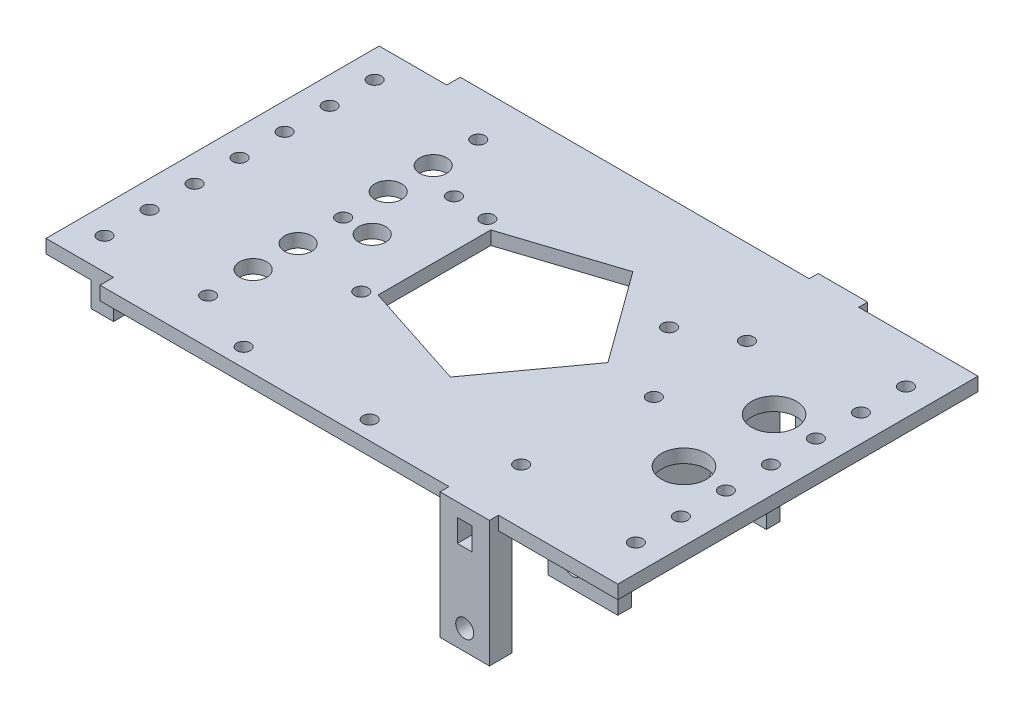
SolidWorks part; units mm, degrees
ref_plane "Plano frontal" through (0, 0, 0) normal (0, 0, 1) x (1, 0, 0)
ref_plane "Plano superior" through (0, 0, 0) normal (0, 1, 0) x (1, 0, 0)
ref_plane "Plano direito" through (0, 0, 0) normal (1, 0, 0) x (0, 0, -1)
sketch "Esboço1" plane through (0, 0, 0) normal (0, 1, 0) x (1, 0, 0)
  line L1 (-67.8295, 32.219) -> (62.1705, 32.219)
  line L2 (-67.8295, 32.219) -> (-67.8295, -47.781)
  line L3 (-67.8295, -47.781) -> (62.1705, -47.781)
  line L4 (62.1705, 32.219) -> (62.1705, -47.781)
  line L5 (-30.6295, -43.6864) -> (-30.6185, -43.6864)
  line L10 (-30.6295, -43.6864) -> (-30.6185, -43.6988)
  line L12 (-30.6185, -43.6864) -> (-30.6185, -43.6988) construction
  line L31 (35.6705, 32.219) -> (24.6705, 32.219)
  line L46 (18.4705, -6.281) -> (3.7526, 13.9765)
  line L47 (3.7526, 13.9765) -> (-20.0615, 6.2388)
  line L48 (-20.0615, 6.2388) -> (-20.0615, -18.8008)
  line L49 (-20.0615, -18.8008) -> (3.7526, -26.5385)
  line L50 (3.7526, -26.5385) -> (18.4705, -6.281)
  circle A0 centre (-25.0295, -43.6864) radius 1.5
  circle A1 centre (2.9705, -43.6864) radius 1.5
  circle A2 centre (-30.6185, 8.6141) radius 1.5
  circle A3 centre (18.4705, 7.3136) radius 1.5
  circle A4 centre (30.1705, -7.781) radius 1.5
  circle A5 centre (-61.8295, 22.219) radius 1.5
  circle A6 centre (-61.8295, 12.219) radius 1.5
  circle A7 centre (-61.8295, 2.219) radius 1.5
  circle A8 centre (-61.8295, -7.781) radius 1.5
  circle A9 centre (-61.8295, -17.781) radius 1.5
  circle A10 centre (-61.8295, -27.781) radius 1.5
  circle A11 centre (-61.8295, -37.781) radius 1.5
  circle A12 centre (56.1705, 22.219) radius 1.5
  circle A13 centre (56.1705, 12.219) radius 1.5
  circle A14 centre (56.1705, 2.219) radius 1.5
  circle A15 centre (56.1705, -7.781) radius 1.5
  circle A16 centre (56.1705, -17.781) radius 1.5
  circle A17 centre (56.1705, -27.781) radius 1.5
  circle A18 centre (56.1705, -37.781) radius 1.5
  circle A19 centre (46.8719, 2.219) radius 5
  circle A20 centre (46.8719, -17.781) radius 5
  circle A21 centre (-38.8295, 22.219) radius 1.5
  circle A22 centre (-38.8295, 12.219) radius 1.5
  circle A23 centre (-38.8295, 2.219) radius 1.5
  circle A24 centre (-38.8295, -7.781) radius 1.5
  circle A25 centre (-38.8295, -17.781) radius 1.5
  circle A26 centre (-38.8295, -27.781) radius 1.5
  circle A27 centre (-38.8295, -37.781) radius 1.5
  point P4 (-32.8295, 32.219)
  point P10 (-32.8295, -43.6864)
  point P13 (-30.6295, -43.6864)
  point P14 (-28.4295, -43.6864)
  point P15 (7.4705, -43.6864)
  point P16 (5.2705, -43.6864)
  point P21 (2.9705, -43.6864)
  point P22 (-25.0295, -43.6864)
  point P27 (18.4705, 22.3142)
  point P28 (-30.6185, 22.3142)
  point P29 (-30.6185, 8.6141)
  point P30 (18.4705, 7.3136)
  point P36 (30.1705, 32.219)
  point P39 (35.6705, 32.219)
  point P40 (24.6705, 32.219)
  point P45 (35.6705, 29.219)
  point P46 (35.6705, -44.781)
  point P51 (35.6705, 10.219)
  point P52 (35.6705, -25.781)
  point P53 (35.6705, 7.219)
  point P54 (35.6705, -22.781)
  point P61 (40.1705, 32.219)
  point P67 (30.1705, -7.781)
  point P74 (-52.8295, 32.219)
  point P75 (-47.8295, 32.219)
  point P80 (-61.8295, 32.219)
  point P81 (56.1705, 32.219)
  point P86 (-61.8295, 22.219)
  point P87 (-61.8295, 17.219)
  point P90 (56.1705, 22.219)
  point P105 (46.8719, 2.219)
  point P106 (46.8719, -17.781)
  point P123 (-2.8295, -6.281)
  point P124 (-38.8295, 32.219)
  point P132 (-38.8295, 22.219)
  dimension "D8" = 18.4705
  dimension "D16" = 62.1705
  dimension "D19" = 2.219
  dimension "D21" = 25.0295
  dimension "D22" = 28.4295
  dimension "D26" = 30.6295
  dimension "D3" = 3
  dimension "D4" = 2.9705
  dimension "D5" = 3.7526
  dimension "D6" = 5.2705
  dimension "D7" = 7.4705
  dimension "D9" = 24.6705
  dimension "D10" = 30.1705
  dimension "D11" = 30.6185
  dimension "D12" = 40.1705
  dimension "D13" = 10
  dimension "D14" = 46.8719
  dimension "D15" = 56.1705
  dimension "D18" = 2.8295
  dimension "D23" = 6.2388
  dimension "D24" = 7.219
  dimension "D25" = 7.3136
  dimension "D28" = 32.8295
  dimension "D29" = 38.8295
  dimension "D30" = 47.8295
  dimension "D31" = 52.8295
  dimension "D32" = 61.8295
  dimension "D33" = 67.8295
  dimension "D34" = 8.6141
  dimension "D35" = 10.219
  dimension "D36" = 12.219
  dimension "D38" = 17.219
  dimension "D39" = 22.3142
  dimension "D40" = 29.219
  dimension "D41" = 32.219
  dimension "D44" = 22.781
  dimension "D45" = 25.781
  dimension "D47" = 43.6864
  dimension "D48" = 43.6988
  dimension "D49" = 44.781
  dimension "D50" = 47.781
  dimension "D17" = 7
  dimension "D20" = 7
  dimension "D27" = 7
extrude "Ressalto-extrusão1" add sketch "Esboço1" along normal blind 3 contours L4 L1 L2 L3 L50 L49 L48 L47 L46 A0 A1 A2 A3 A4 A5 A6 A7 A8 A9 A10 A11 A12 A13 A14 A15 A16 A17 A18
sketch "Esboço2" plane through (0, 0, 0) normal (0, -1, 0) x (1, 0, 0)
  line L0 (-67.8295, 47.781) -> (62.1705, 47.781) construction
  line L1 (-57.8295, 47.781) -> (-57.8295, -32.219)
  line L2 (-67.8295, -32.219) -> (62.1705, -32.219) construction
  line L3 (-52.8295, 47.781) -> (-52.8295, -32.219)
  line L4 (-52.8295, -32.219) -> (-57.8295, -32.219)
  line L5 (-57.8295, 47.781) -> (-52.8295, 47.781)
  point P0 (-57.8295, 47.781)
  point P1 (-52.8295, 47.781)
  dimension "D1" = 10
  dimension "D2" = 5
extrude "Ressalto-extrusão3" add sketch "Esboço2" along normal blind 11 contours L1 L4 L3 L5
sketch "Esboço6" plane through (-57.8295, 0, 0) normal (-1, 0, 0) x (0, 0, 1)
  line L0 (-32.219, -5.5) -> (-12.219, -5.5)
  line L1 (-32.219, -11) -> (-32.219, 0) construction
  line L2 (47.781, -11) -> (47.781, 0) construction
  line L3 (47.781, -11) -> (-32.219, -11) construction
  line L4 (-8.219, -11) -> (-12.219, -5.5)
  line L5 (23.781, -11) -> (27.781, -5.5)
  line L8 (27.781, -5.5) -> (47.781, -5.5)
  circle A0 centre (-2.219, -5.5) radius 2.75
  circle A1 centre (17.781, -5.5) radius 2.75
  point P6 (-2.219, -5.5)
  point P7 (17.781, -5.5)
  point P12 (-8.219, -11)
  point P13 (-12.219, -5.5)
  point P16 (23.781, -11)
  point P17 (27.781, -5.5)
  dimension "D3" = 5.5
  dimension "D4" = 5.5
  dimension "D1" = 30
  dimension "D2" = 30
  dimension "D5" = 20
  dimension "D6" = 24
  dimension "D7" = 20
  dimension "D8" = 24
extrude "Corte-extrusão3" cut sketch "Esboço6" against normal through all contours L4 L0 M3 M2 | A0 | A1 | L8 L5 M3 M4
sketch "Esboço7" plane through (0, 0, 0) normal (0, -1, 0) x (1, 0, 0)
  line L0 (-52.8295, 47.781) -> (62.1705, 47.781) construction
  line L1 (24.6705, 47.781) -> (24.6705, -32.219) construction
  line L2 (-52.8295, -32.219) -> (62.1705, -32.219) construction
  line L3 (30.1705, 47.781) -> (30.1705, -32.219) construction
  line L4 (35.6705, 47.781) -> (35.6705, -32.219) construction
  line L5 (40.1705, 47.781) -> (40.1705, -32.219) construction
  line L6 (40.1705, 44.781) -> (24.6705, 44.781) construction
  line L7 (40.1705, 25.781) -> (24.6705, 25.781) construction
  line L8 (40.1705, 22.781) -> (24.6705, 22.781) construction
  line L9 (40.1705, -29.219) -> (24.6705, -29.219) construction
  line L10 (40.1705, -10.219) -> (24.6705, -10.219) construction
  line L11 (40.1705, -7.219) -> (24.6705, -7.219) construction
  line L12 (-52.8295, 47.781) -> (-52.8295, -32.219) construction
  line L13 (24.6705, -7.219) -> (40.1705, -7.219)
  line L14 (24.6705, -7.219) -> (24.6705, -10.219)
  line L15 (24.6705, -10.219) -> (40.1705, -10.219)
  line L16 (40.1705, -7.219) -> (40.1705, -10.219)
  line L17 (24.6705, 25.781) -> (40.1705, 25.781)
  line L18 (24.6705, 25.781) -> (24.6705, 22.781)
  line L19 (24.6705, 22.781) -> (40.1705, 22.781)
  line L20 (40.1705, 25.781) -> (40.1705, 22.781)
  line L21 (-52.8295, 23.781) -> (-52.8295, -8.219) construction
  line L25 (-52.8295, 10.2642) -> (-52.8295, 5.2978)
  line L27 (24.6705, -29.219) -> (35.6705, -29.219)
  line L28 (24.6705, -29.219) -> (24.6705, -32.219)
  line L29 (24.6705, -32.219) -> (35.6705, -32.219)
  line L30 (35.6705, -29.219) -> (35.6705, -32.219)
  line L31 (24.6705, 47.781) -> (35.6705, 47.781)
  line L32 (24.6705, 47.781) -> (24.6705, 44.781)
  line L33 (24.6705, 44.781) -> (35.6705, 44.781)
  line L34 (35.6705, 47.781) -> (35.6705, 44.781)
  point P0 (30.1705, 47.781)
  point P1 (24.6705, 47.781)
  point P5 (35.6705, 47.781)
  point P6 (40.1705, 47.781)
  point P17 (40.1705, 44.781)
  point P18 (40.1705, 25.781)
  point P19 (40.1705, 22.781)
  point P26 (40.1705, -29.219)
  point P27 (40.1705, -10.219)
  point P28 (40.1705, -7.219)
  point P35 (-52.8295, 7.781)
  point P36 (-48.0054, 7.781)
  point P39 (-48.0054, 7.781)
  dimension "D1" = 32
  dimension "D2" = 5.5
  dimension "D3" = 5.5
  dimension "D4" = 10
  dimension "D5" = 3
  dimension "D6" = 19
  dimension "D7" = 3
  dimension "D8" = 3
  dimension "D9" = 19
  dimension "D10" = 3
sketch "Esboço9" plane through (0, 0, 0) normal (0, -1, 0) x (1, 0, 0)
  line L0 (-52.8295, 47.781) -> (62.1705, 47.781) construction
  line L1 (30.1705, 47.781) -> (30.1705, -32.219) construction
  line L2 (-52.8295, -32.219) -> (62.1705, -32.219) construction
  line L3 (24.6705, 47.781) -> (24.6705, -32.219) construction
  line L4 (35.6705, 47.781) -> (35.6705, -32.219) construction
  line L5 (40.1705, 47.781) -> (40.1705, -32.219) construction
  line L6 (40.1705, 25.781) -> (24.6705, 25.781) construction
  line L7 (40.1705, 22.781) -> (24.6705, 22.781) construction
  line L8 (40.1705, -7.219) -> (24.6705, -7.219) construction
  line L9 (40.1705, -10.219) -> (24.6705, -10.219) construction
  line L11 (24.6705, 25.781) -> (40.1705, 25.781)
  line L12 (24.6705, 25.781) -> (24.6705, 22.781)
  line L13 (24.6705, 22.781) -> (40.1705, 22.781)
  line L14 (40.1705, 25.781) -> (40.1705, 22.781)
  line L15 (24.6705, -7.219) -> (40.1705, -7.219)
  line L16 (24.6705, -7.219) -> (24.6705, -10.219)
  line L17 (24.6705, -10.219) -> (40.1705, -10.219)
  line L18 (40.1705, -7.219) -> (40.1705, -10.219)
  line L19 (40.1705, 22.781) -> (35.6705, 22.781)
  line L20 (40.1705, 22.781) -> (40.1705, -7.219)
  line L21 (40.1705, -7.219) -> (35.6705, -7.219)
  line L22 (35.6705, 22.781) -> (35.6705, -7.219)
  point P0 (30.1705, 47.781)
  point P1 (35.6705, 47.781)
  point P5 (24.6705, 47.781)
  point P6 (40.1705, 47.781)
  point P17 (40.1705, 25.781)
  point P18 (40.1705, 22.781)
  point P19 (40.1705, -7.219)
  point P20 (40.1705, -10.219)
  dimension "D1" = 32
  dimension "D2" = 10
  dimension "D3" = 5.5
  dimension "D4" = 5.5
  dimension "D5" = 22
  dimension "D6" = 22
  dimension "D7" = 3
  dimension "D8" = 3
extrude "Ressalto-extrusão7" add sketch "Esboço7" along normal blind 25 contours L27 L30 L29 L28 | L17 L20 L19 L18 | L33 L34 L31 L32 | L13 L16 L15 L14
sketch "Esboço11" plane through (0, 0, 47.781) normal (0, 0, 1) x (1, 0, 0)
  line L2 (40.1705, 0) -> (24.6705, 0) construction
  line L3 (28.5205, -5) -> (31.8205, -5)
  line L4 (28.5205, -5) -> (28.5205, 0)
  line L5 (28.5205, 0) -> (31.8205, 0)
  line L6 (31.8205, -5) -> (31.8205, 0)
  circle A0 centre (30.1705, -20.5) radius 2
  point P5 (30.1705, -20.5)
  point P6 (30.1705, -5)
  point P7 (30.1705, -2.5)
  point P8 (30.1705, -2.5)
  dimension "D5" = 4
  dimension "D3" = 2.5
  dimension "D4" = 3.3
extrude "Corte-extrusão5" cut sketch "Esboço11" against normal through all
extrude "Ressalto-extrusão8" add sketch "Esboço9" along normal blind 20 contours L19 L22 L21 L20
sketch "Esboço12" plane through (40.1705, 0, 0) normal (1, 0, 0) x (0, 0, -1)
  line L0 (-25.781, 0) -> (10.219, 0) construction
  line L2 (7.219, 0) -> (7.219, -20) construction
  circle A0 centre (-12.781, -10) radius 3
  circle A1 centre (-2.781, -10) radius 3
  point P0 (7.219, 0)
  point P1 (-22.781, 0)
  point P12 (-12.781, -10)
  point P13 (-2.781, -10)
  dimension "D4" = 6
  dimension "D5" = 6
  dimension "D1" = 30
extrude "Corte-extrusão7" cut sketch "Esboço12" against normal blind 10 contours A0 | A1
sketch "Esboço13" plane through (0, 3, 0) normal (0, 1, 0) x (1, 0, 0)
  line L0 (-67.8295, 32.219) -> (62.1705, 32.219) construction
  line L1 (-67.8295, 32.219) -> (-67.8295, -47.781) construction
  line L3 (-67.8295, -47.781) -> (-52.8295, -47.781)
  line L4 (-67.8295, -47.781) -> (-67.8295, -44.781)
  line L5 (-67.8295, -44.781) -> (-52.8295, -44.781)
  line L6 (-52.8295, -47.781) -> (-52.8295, -44.781)
  line L7 (-67.8295, 32.219) -> (-52.8295, 32.219)
  line L8 (-67.8295, 32.219) -> (-67.8295, 29.219)
  line L9 (-67.8295, 29.219) -> (-52.8295, 29.219)
  line L10 (-52.8295, 32.219) -> (-52.8295, 29.219)
  point P0 (-52.8295, 32.219)
  point P1 (-67.8295, 29.219)
  point P5 (-52.8295, -47.781)
  point P8 (-67.8295, -44.781)
  dimension "D1" = 15
  dimension "D2" = 3
  dimension "D3" = 3
extrude "Corte-extrusão8" cut sketch "Esboço13" against normal through all
sketch "Esboço14" plane through (0, 0, 47.781) normal (0, 0, 1) x (1, 0, 0)
  line L0 (-52.8295, 3) -> (62.1705, 3) construction
  line L1 (24.6705, -25) -> (35.6705, -25)
  line L2 (24.6705, -25) -> (24.6705, 3)
  line L3 (24.6705, 3) -> (35.6705, 3)
  line L4 (35.6705, -25) -> (35.6705, 3)
  line L6 (28.5205, 0) -> (31.8205, 0)
  line L7 (28.5205, 0) -> (28.5205, -5)
  line L8 (28.5205, -5) -> (31.8205, -5)
  line L9 (31.8205, 0) -> (31.8205, -5)
  circle A0 centre (30.1705, -20.5) radius 2
  point P0 (26.4179, -19.2342)
extrude "Ressalto-extrusão9" add sketch "Esboço14" along normal blind 2 contours A0 | L8 L9 L6 L7 | L2 L3 L4 L1
sketch "Esboço16" plane through (0, 0, -32.219) normal (0, 0, -1) x (-1, 0, 0)
  line L0 (52.8295, 3) -> (-62.1705, 3) construction
  line L1 (-35.6705, -25) -> (-24.6705, -25)
  line L2 (-35.6705, -25) -> (-35.6705, 3)
  line L3 (-35.6705, 3) -> (-24.6705, 3)
  line L4 (-24.6705, -25) -> (-24.6705, 3)
  line L6 (-31.8205, 0) -> (-28.5205, 0)
  line L7 (-31.8205, 0) -> (-31.8205, -5)
  line L8 (-31.8205, -5) -> (-28.5205, -5)
  line L9 (-28.5205, 0) -> (-28.5205, -5)
  circle A0 centre (-30.1705, -20.5) radius 2
  point P0 (-33.2327, -8.7981)
extrude "Ressalto-extrusão10" add sketch "Esboço16" along normal blind 2
sketch "Esboço18" plane through (0, 3, 0) normal (0, 1, 0) x (1, 0, 0)
  circle A0 centre (-22.5673, 7.9773) radius 1.5
  circle A1 centre (-22.5673, -20.0227) radius 1.5
  circle A2 centre (29.7327, 13.3373) radius 1.5
  circle A3 centre (28.4327, -35.5227) radius 1.5
extrude "Corte-extrusão9" cut sketch "Esboço18" against normal blind 10
sketch "Esboço19" plane through (0, 3, 0) normal (0, 1, 0) x (1, 0, 0)
  circle A0 centre (-38.8295, 12.219) radius 3
  circle A1 centre (-38.8295, 2.219) radius 3
  circle A2 centre (-38.8295, -17.781) radius 3
  circle A3 centre (-38.8295, -27.781) radius 3
  circle A4 centre (-32.3809, -7.781) radius 3
  dimension "D1" = 6
  dimension "D2" = 6
  dimension "D3" = 6
  dimension "D4" = 6
  dimension "6" = 6
extrude "Corte-extrusão10" cut sketch "Esboço19" against normal blind 10
